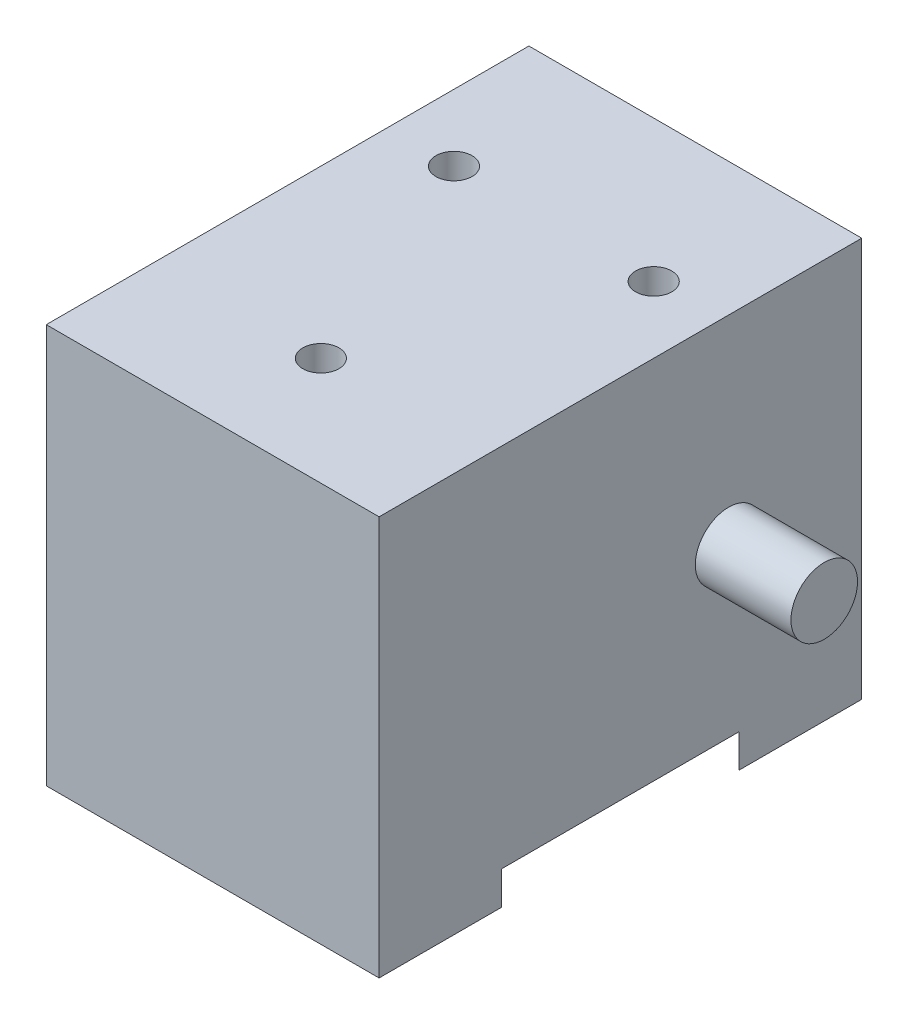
SolidWorks part; units mm, degrees
ref_plane "Front Plane" through (0, 0, 0) normal (0, 0, 1) x (1, 0, 0)
ref_plane "Top Plane" through (0, 0, 0) normal (0, 1, 0) x (1, 0, 0)
ref_plane "Right Plane" through (0, 0, 0) normal (1, 0, 0) x (0, 0, -1)
sketch "Sketch1" plane through (0, 0, 0) normal (0, 1, 0) x (1, 0, 0)
  line L1 (-15.875, 23.0188) -> (15.875, 23.0188)
  line L2 (-15.875, 23.0188) -> (-15.875, -23.0187)
  line L3 (-15.875, -23.0187) -> (15.875, -23.0187)
  line L4 (15.875, 23.0188) -> (15.875, -23.0187)
  line L5 (-15.875, 23.0188) -> (15.875, -23.0187) construction
  line L6 (-15.875, -23.0187) -> (15.875, 23.0188) construction
  point P0 (0, 0)
  dimension "D1" = 31.75
  dimension "D2" = 46.0375
extrude "Boss-Extrude1" add sketch "Sketch1" along normal blind 38.1
hole_wizard "#5 Clearance Hole1" positions "3DSketch1" profile "Sketch2" hole size "#5" standard "Ansi Inch"
sketch3d "3DSketch1"
  line L0 (-15.875, 38.1, -23.0188) -> (-15.875, 38.1, 23.0187) construction
  line L1 (-15.875, 38.1, 23.0187) -> (15.875, 38.1, 23.0187) construction
  point P0 (-9.525, 38.1, -9.5237)
  point P2 (9.525, 38.1, -9.5237)
  point P4 (0, 38.1, 12.7013)
  dimension "D1" = 6.35
  dimension "D2" = 19.05
  dimension "D3" = 15.875
  dimension "D4" = 10.3175
  dimension "D5" = 24.1801
  dimension "D6" = 24.1801
sketch "Sketch2" plane through (-9.525, 38.1, -9.5237) normal (1, 0, 0) x (0, 0, 1)
  line L0 (0, 0) -> (0, 20.0878)
  line L1 (0, 20.0878) -> (1.7272, 19.05)
  line L2 (1.7272, 19.05) -> (1.7272, 0)
  line L5 (1.7272, 0) -> (0, 0)
  line L10 (0, 20.0878) -> (-1.7272, 19.05) construction
  line L11 (0, -6.35) -> (0, 107.95) construction
  dimension "Hole Dia." = 3.4544
  dimension "Hole Depth" = 19.05
  dimension "Drill Angle" = 118
sketch "Sketch3" plane through (0, 0, 0) normal (0, -1, 0) x (1, 0, 0)
  line L0 (-15.875, 11.3241) -> (-15.875, -11.3241)
  line L1 (-15.875, -23.0188) -> (-15.875, 23.0187) construction
  line L2 (15.875, 11.3241) -> (15.875, -11.3241)
  line L3 (15.875, 23.0187) -> (15.875, -23.0188) construction
  arc A0 (-15.875, -11.3241) -> (15.875, -11.3241) centre (0, 0) ccw
  arc A1 (15.875, 11.3241) -> (-15.875, 11.3241) centre (0, 0) ccw
  dimension "D1" = 39
extrude "Cut-Extrude1" cut sketch "Sketch3" against normal blind 3.175
sketch "Sketch4" plane through (0, 0, 0) normal (1, 0, 0) x (0, 0, -1)
  line L0 (23.0188, 38.1) -> (23.0188, 0) construction
  line L1 (11.3241, 0) -> (23.0188, 0) construction
  circle A0 centre (10.3188, 19.05) radius 3.175
  dimension "D3" = 6.35
  dimension "D1" = 12.7
  dimension "D2" = 19.05
extrude "Boss-Extrude2" add sketch "Sketch4" along normal mid plane 50
